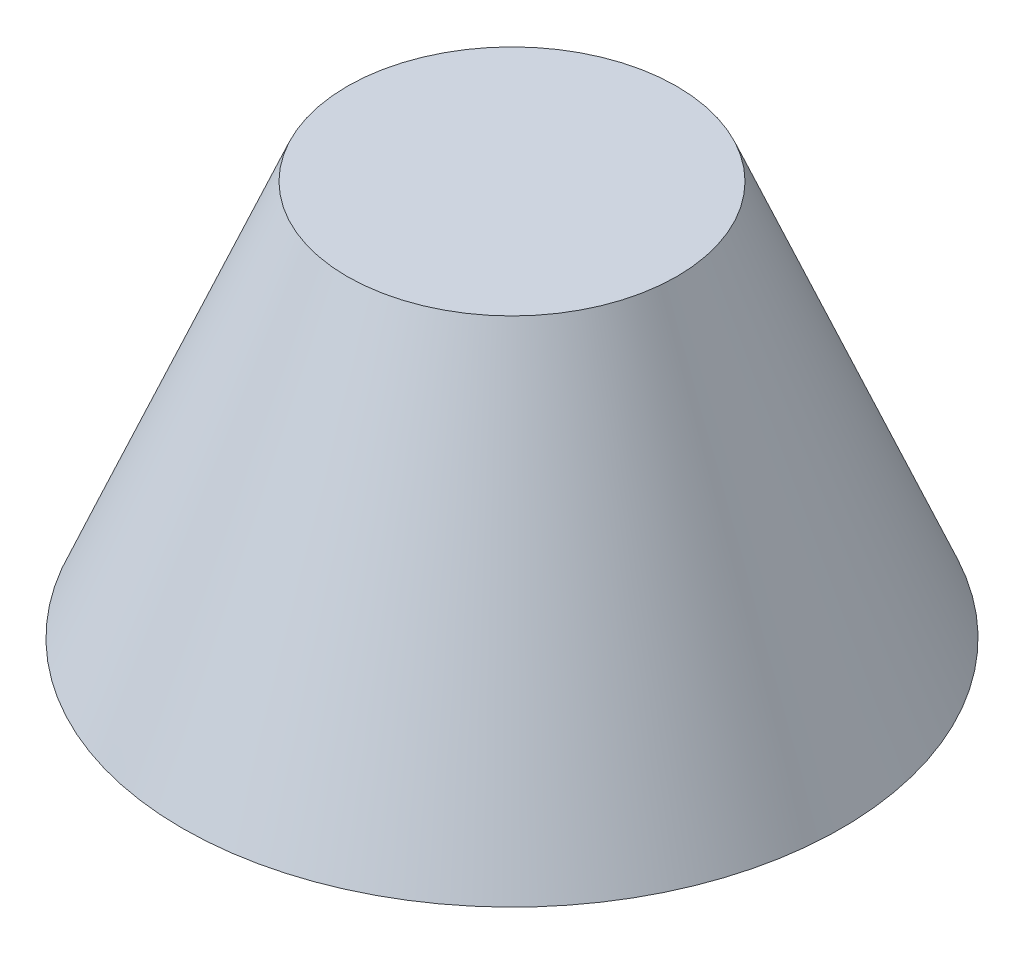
SolidWorks part; units mm, degrees
ref_plane "前视基准面" through (0, 0, 0) normal (0, 0, 1) x (1, 0, 0)
ref_plane "上视基准面" through (0, 0, 0) normal (0, 1, 0) x (1, 0, 0)
ref_plane "右视基准面" through (0, 0, 0) normal (1, 0, 0) x (0, 0, -1)
sketch "草图1" plane through (0, 0, 0) normal (0, 0, 1) x (1, 0, 0)
  line L0 (0, 42.0218) -> (0, -40.5369) construction
  line L1 (0, 34.6087) -> (-25, 34.6087)
  line L2 (-25, 34.6087) -> (-50, -25.3913)
  line L3 (-50, -25.3913) -> (0, -25.3913)
  line L4 (0, -25.3913) -> (0, 34.6087)
  dimension "D1" = 25
  dimension "D2" = 50
  dimension "D3" = 60
revolve "旋转1" add sketch "草图1" angle 360 about L0
